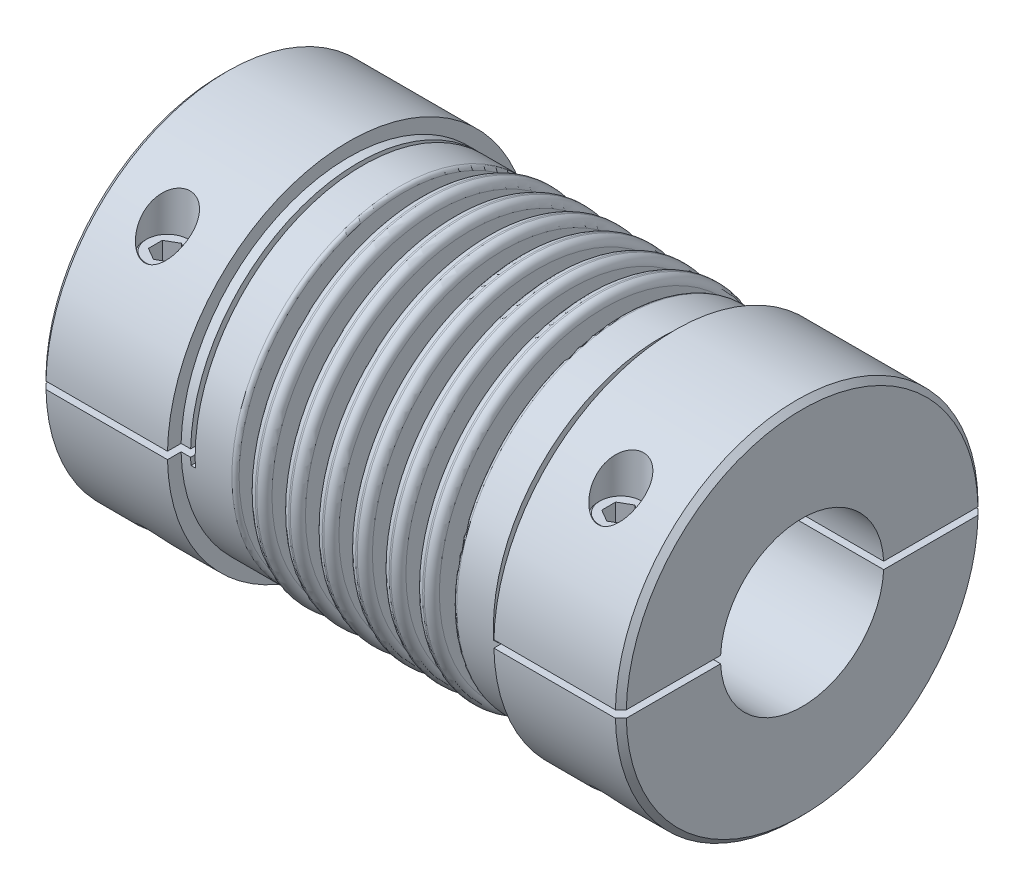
SolidWorks part; units mm, degrees
ref_plane "Plan de face" through (0, 0, 0) normal (0, 0, 1) x (1, 0, 0)
ref_plane "Plan de dessus" through (0, 0, 0) normal (0, 1, 0) x (1, 0, 0)
ref_plane "Plan de droite" through (0, 0, 0) normal (1, 0, 0) x (0, 0, -1)
imported_body "Importée1"
sketch "Esquisse2" plane through (32, 0, 0) normal (1, 0, 0) x (0, 0, -1)
  line L0 (2.9933, 0.2) -> (9.6979, 0.2)
  line L1 (-2.9933, 0.2) -> (-9.6979, 0.2)
  arc A0 (2.9933, 0.2) -> (-2.9933, 0.2) centre (0, 0) ccw construction
  arc A1 (2.9933, 0.2) -> (-2.9933, 0.2) centre (0, 0) ccw
  arc A2 (9.6979, 0.2) -> (-9.6979, 0.2) centre (0, 0) ccw construction
  arc A3 (9.6979, 0.2) -> (-9.6979, 0.2) centre (0, 0) ccw
extrude "Extrusion1" add sketch "Esquisse2" against normal blind 1
sketch "Esquisse1" plane through (0, 0, 0) normal (-1, 0, 0) x (0, 0, 1)
  circle A0 centre (0, 0) radius 4.5
  dimension "D1" = 9
extrude "Enlèv. mat.-Extru.1" cut sketch "Esquisse1" against normal through all
